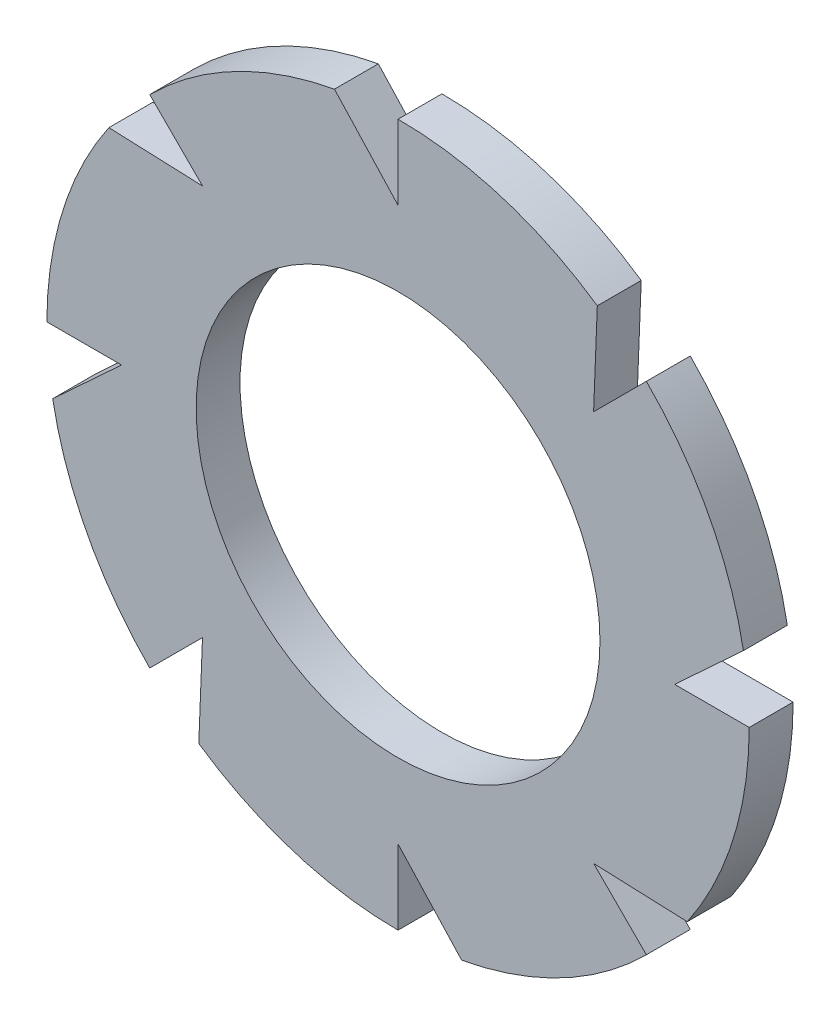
SolidWorks part; units mm, degrees
ref_plane "Front" through (0, 0, 0) normal (0, 0, 1) x (1, 0, 0)
ref_plane "Top" through (0, 0, 0) normal (0, 1, 0) x (1, 0, 0)
ref_plane "Right" through (0, 0, 0) normal (1, 0, 0) x (0, 0, -1)
sketch "Sketch1" plane through (0, 0, 0) normal (0, 0, 1) x (1, 0, 0)
  circle A0 centre (0, 0) radius 4
  circle A1 centre (0, 0) radius 2.3
  dimension "D0" = 8
  dimension "d" = 4.6
extrude "Base-Extrude" add sketch "Sketch1" against normal blind 0.5
sketch "Sketch2" plane through (-0.667, 2.3716, 0) normal (0, 0, 1) x (1, 0, 0)
  line L0 (0.667, 1.6284) -> (0.667, 0.7784)
  line L1 (0.667, 0.7784) -> (-0.1184, 1.6284)
  line L2 (-0.1184, 1.6284) -> (0.667, 1.6284)
  line L3 (0.667, -2.3716) -> (8.667, -2.3716) construction
  circle A0 centre (0.667, -2.3716) radius 3.15 construction
  circle A1 centre (0.667, -2.3716) radius 2.3 construction
  circle A3 centre (0.667, -2.3716) radius 4 construction
  dimension "D1" = 6.3
  dimension "D2" = 0.7854
  dimension "D3" = 8
extrude "TypeASlot" cut sketch "Sketch2" against normal through all
pattern_circular "TypeAPattern" count 8 over 360 about axis through (0, 0, 0) along (0, 0, 1) of "TypeASlot"
equation "\"D1@Sketch2\" = (  \"D0@Sketch1\" + \"d@Sketch1\" )  / 2"
equation "\"D2@Sketch2\" = \"D0@Sketch1\" * 3.14159 / \"D3@Sketch2\" / 4"
